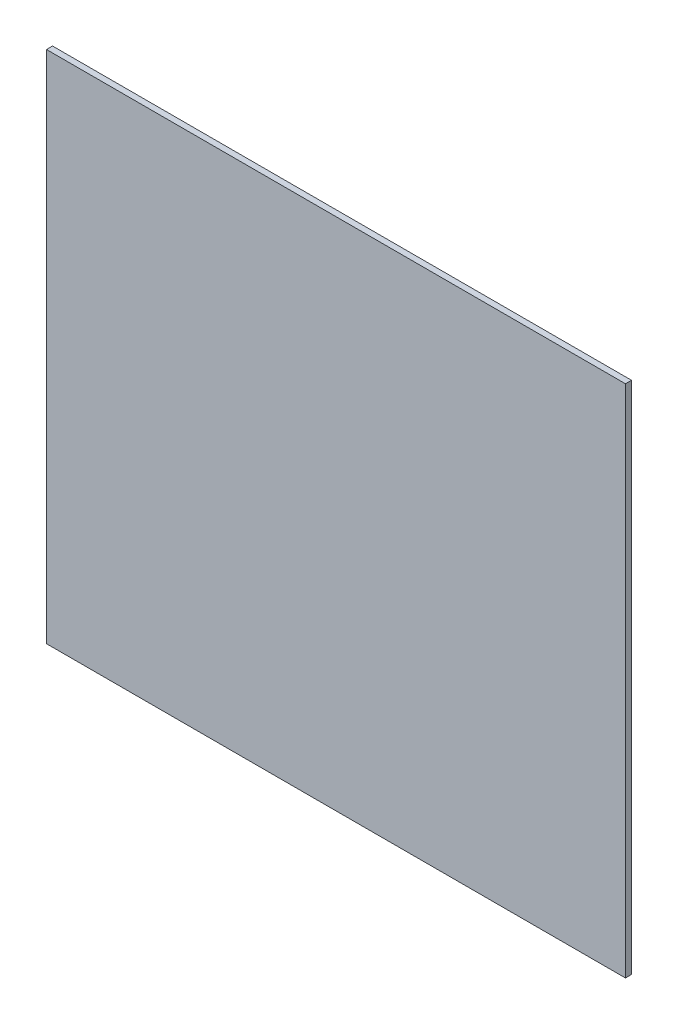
SolidWorks part; units mm, degrees
ref_plane "Front Plane" through (0, 0, 0) normal (0, 0, 1) x (1, 0, 0)
ref_plane "Top Plane" through (0, 0, 0) normal (0, 1, 0) x (1, 0, 0)
ref_plane "Right Plane" through (0, 0, 0) normal (1, 0, 0) x (0, 0, -1)
sketch "Sketch1" plane through (0, 0, 0) normal (0, 0, 1) x (1, 0, 0)
  line L1 (-72.0845, 46.0647) -> (49.3413, 46.0647)
  line L2 (-72.0845, 46.0647) -> (-72.0845, -61.8693)
  line L3 (-72.0845, -61.8693) -> (49.3413, -61.8693)
  line L4 (49.3413, 46.0647) -> (49.3413, -61.8693)
sheet metal parameters "Sheet-Metal1" thickness 1.27 parameters "D1"=2
base flange "Base-Flange1" sketch "Sketch1" thickness 1.27 reverse thickness direction no parameters "D1"=2
flat pattern "Flat-Pattern1"
sketch "Bend-Lines1" plane through (0, 0, 0) normal (0, 1, 0) x (1, 0, 0)
sketch3d "Bounding-Box1" [suppressed]
  line L0 (72.0845, -61.8693, 0) -> (-49.3413, -61.8693, 0) construction
  line L1 (72.0845, 46.0647, 0) -> (-49.3413, 46.0647, 0) construction
  line L2 (72.0845, -61.8693, 0) -> (72.0845, 46.0647, 0) construction
  line L3 (-49.3413, -61.8693, 0) -> (-49.3413, 46.0647, 0) construction
